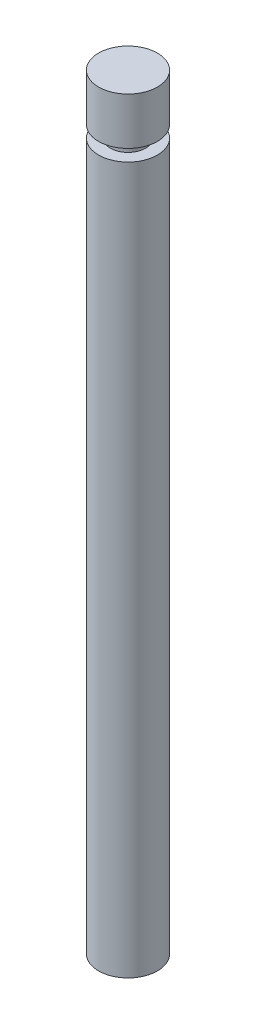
SolidWorks part; units mm, degrees
ref_plane "Front Plane" through (0, 0, 0) normal (0, 0, 1) x (1, 0, 0)
ref_plane "Top Plane" through (0, 0, 0) normal (0, 1, 0) x (1, 0, 0)
ref_plane "Right Plane" through (0, 0, 0) normal (1, 0, 0) x (0, 0, -1)
sketch "Sketch1" plane through (0, 0, 0) normal (0, 1, 0) x (1, 0, 0)
  circle A0 centre (0, 0) radius 1.5875
  dimension "D1" = 3.175
extrude "Extrude1" add sketch "Sketch1" along normal blind 38.1
sketch "Sketch2" plane through (0, 38.1, 0) normal (0, 1, 0) x (1, 0, 0)
  circle A2 centre (0, 0) radius 0.9525
  circle A3 centre (0, 0) radius 0.9525
  dimension "D1" = 0.635
extrude "Extrude2" add sketch "Sketch2" along normal blind 0.635
sketch "Sketch3" plane through (0, 38.735, 0) normal (0, 1, 0) x (1, 0, 0)
  circle A2 centre (0, 0) radius 1.5875
  circle A3 centre (0, 0) radius 1.5875
  dimension "D1" = 0.635
extrude "Extrude3" add sketch "Sketch3" along normal blind 2.54
